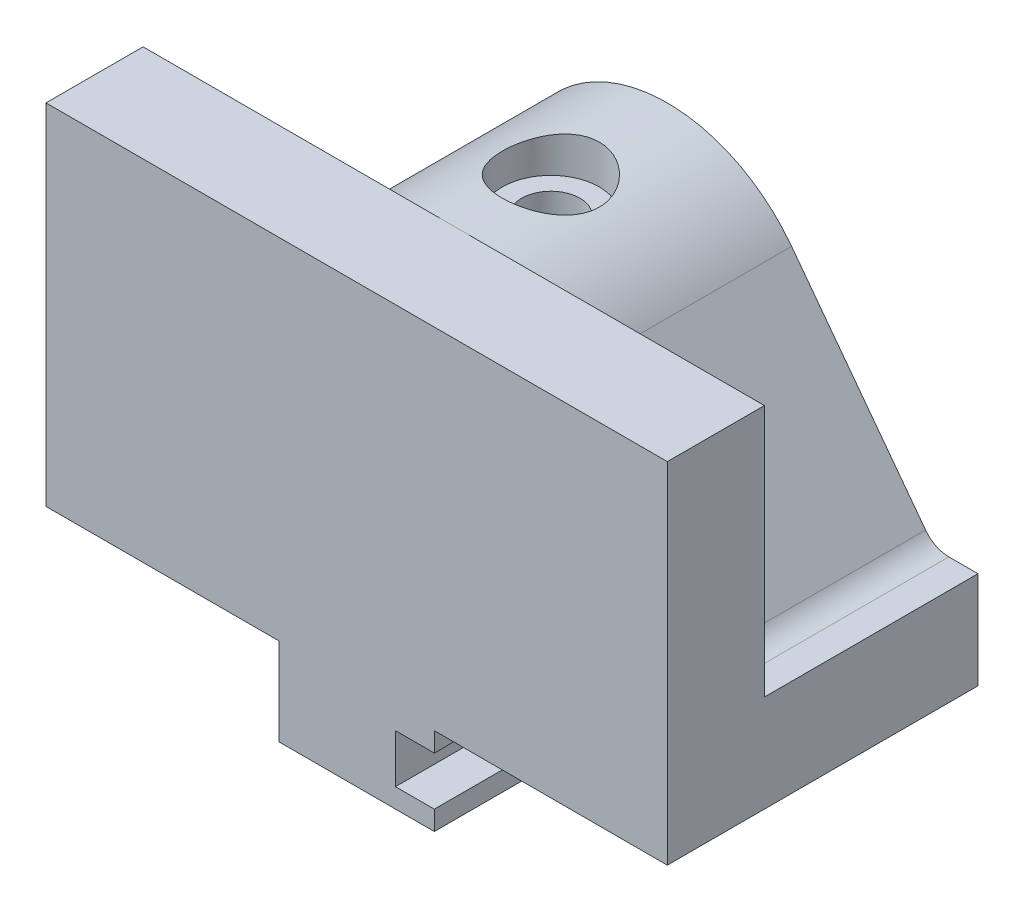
SolidWorks part; units mm, degrees
other "<vice-jaw>-<Cut-Extrude2>"
ref_plane "Front Plane" through (0, 0, 0) normal (0, 0, 1) x (1, 0, 0)
ref_plane "Top Plane" through (0, 0, 0) normal (0, 1, 0) x (1, 0, 0)
ref_plane "Right Plane" through (0, 0, 0) normal (1, 0, 0) x (0, 0, -1)
mirrored part "vice-jaw_Mirrored"
